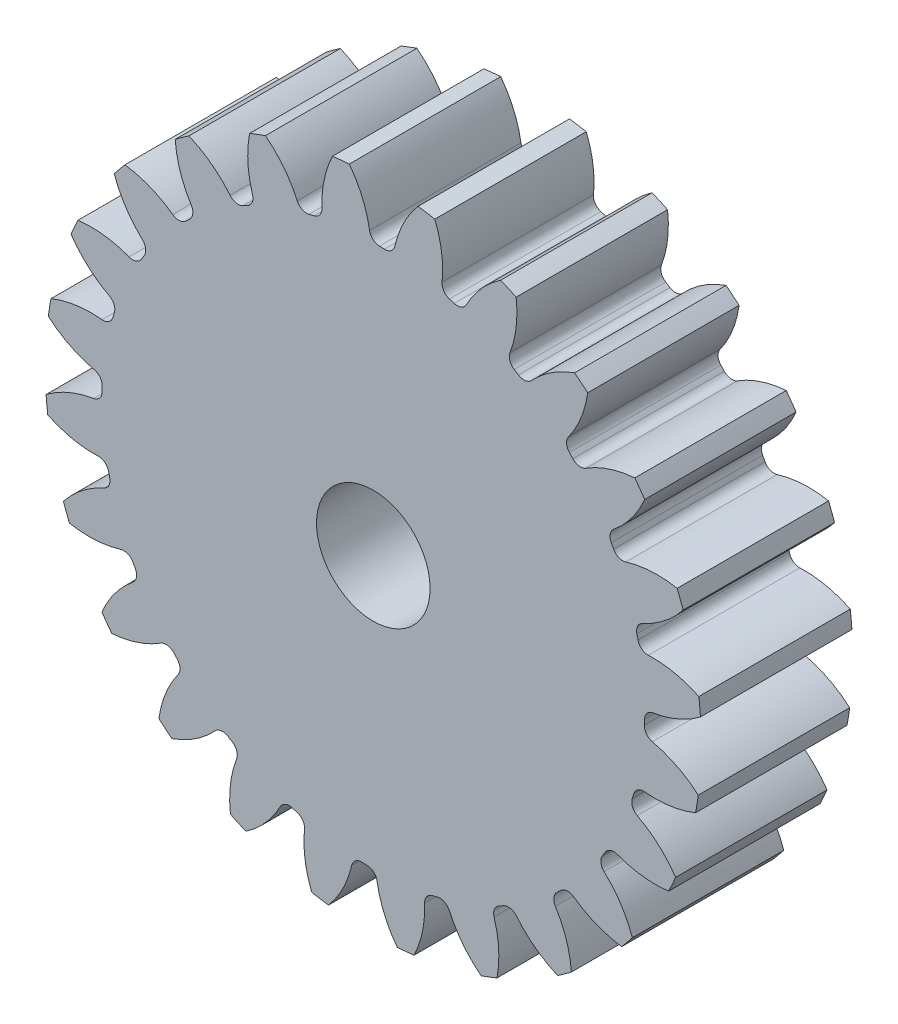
SolidWorks part; units mm, degrees
ref_plane "Front" through (0, 0, 0) normal (0, 0, 1) x (1, 0, 0)
ref_plane "Top" through (0, 0, 0) normal (0, 1, 0) x (1, 0, 0)
ref_plane "Right" through (0, 0, 0) normal (1, 0, 0) x (0, 0, -1)
sketch "Sketch3" plane through (0, 0, 0) normal (0, 0, 1) x (1, 0, 0)
  circle A0 centre (0, 0) radius 220.1333
  dimension "od" = 440.2667
extrude "gearBody" add sketch "Sketch3" along normal blind 101.6
sketch "Sketch2" plane through (0, 0, 0) normal (0, 0, 1) x (1, 0, 0)
  line L0 (0, 0) -> (176.4107, 73.0717) construction
  line L1 (218.6286, -30.5574) -> (0, 0) construction
  line L2 (0, 0) -> (36.3143, 0) construction
  line L3 (203.0872, 6.7699) -> (202.2409, -19.7197) construction
  line L5 (202.664, -6.4749) -> (0, 0) construction
  line L7 (0, 0) -> (190.9455, 0) construction
  arc A0 (190.9205, 3.0929) -> (190.3337, -15.2736) centre (0, 0) ccw construction
  arc A1 (219.5446, 16.0889) -> (218.0699, -30.0703) centre (0, 0) ccw construction
  arc A2 (203.0872, 6.7699) -> (202.2409, -19.7197) centre (0, 0) ccw construction
  arc A3 (181.8791, -7.4921) -> (181.9864, -4.133) centre (0, 0) ccw
  arc A4 (218.6286, -30.5574) -> (187.2366, -14.496) centre (171.3865, -84.1835) ccw
  arc A5 (218.6286, -30.5574) -> (220.1333, 16.5394) centre (0, 0) ccw
  arc A6 (220.1333, 16.5394) -> (187.7801, 2.5146) centre (176.4107, 73.0717) cw
  arc A7 (181.9864, -4.133) -> (187.7801, 2.5146) centre (188.8765, -4.2895) cw
  arc A8 (187.2366, -14.496) -> (181.8791, -7.4921) centre (188.7651, -7.7758) cw
  point P6 (220.1333, 16.5394)
  point P22 (218.6286, -30.5574)
  dimension "baseDia" = 381.8911
  dimension "od" = 440.2667
  dimension "pd" = 406.4
  dimension "rd" = 364.0667
  dimension "rFillet" = 6.8919
  dimension "pointX" = 220.1333
  dimension "pointY" = 16.5394
  dimension "CTT" = 26.4896
  dimension "flankCenterAngle" = 22.5
extrude "toothCut" cut sketch "Sketch2" along normal through all
pattern_circular "CirPattern1" count 24 over 360 about axis through (0, 0, 0) along (0, 0, 1) of "toothCut"
sketch "hub1Dia" plane through (0, 0, 0) normal (0, 0, -1) x (-1, 0, 0)
  circle A0 centre (0, 0) radius 12.7
  dimension "hub1Dia" = 25.4
sketch "hub2Dia" plane through (0, 0, 101.6) normal (0, 0, 1) x (1, 0, 0)
  circle A0 centre (0, 0) radius 12.7
  dimension "hub2dia" = 25.4
sketch "boreDia" plane through (0, 0, 0) normal (0, 0, 1) x (1, 0, 0)
  circle A0 centre (0, 0) radius 38.1
  dimension "boreDia" = 76.2
extrude "bore" cut sketch "boreDia" against normal mid plane 25400
